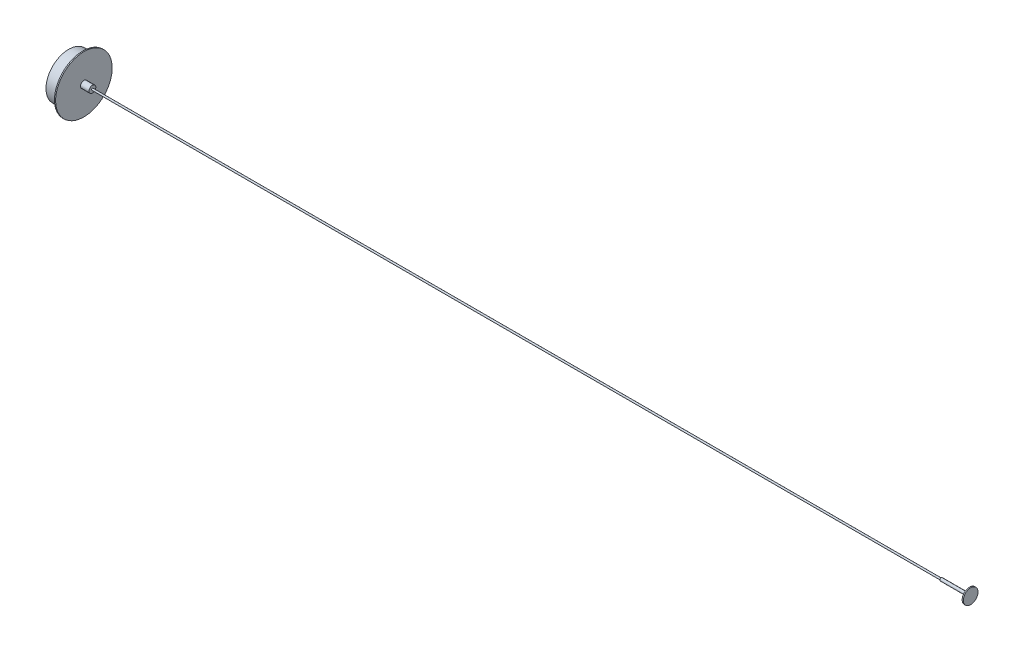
SolidWorks part; units mm, degrees
ref_plane "Alzado" through (0, 0, 0) normal (0, 0, 1) x (1, 0, 0)
ref_plane "Planta" through (0, 0, 0) normal (0, 1, 0) x (1, 0, 0)
ref_plane "Vista lateral" through (0, 0, 0) normal (1, 0, 0) x (0, 0, -1)
sketch "Croquis1" plane through (0, 0, 0) normal (0, 0, 1) x (1, 0, 0)
  line L0 (0, 0) -> (60, 0)
  line L2 (60, 0) -> (60, 80)
  dimension "D1" = 60
  dimension "D3" = 80
sketch "Croquis114" plane through (0, 0, 0) normal (-1, 0, 0) x (0, 0, 1)
  circle A0 centre (0, 0) radius 40
  dimension "D1" = 80
extrude "Saliente-Extruir1" add sketch "Croquis114" along normal blind 25
fillet "Redondeo1" radius 1 1 edges at (0, -40, 0)
sketch "Croquis115" plane through (0, 0, 0) normal (1, 0, 0) x (0, 0, -1)
  circle A0 centre (0, 0) radius 50
extrude "Saliente-Extruir2" add sketch "Croquis115" along normal blind 2
sketch "Croquis122" plane through (2, 0, 0) normal (1, 0, 0) x (0, 0, -1)
  circle A0 centre (0, 0) radius 6
  dimension "D1" = 12
extrude "Saliente-Extruir3" add sketch "Croquis122" along normal blind 15 separate body
sketch "Croquis123" plane through (17, 0, 0) normal (1, 0, 0) x (0, 0, -1)
  circle A0 centre (0, 0) radius 1.5
  dimension "D1" = 3
extrude "Saliente-Extruir4" add sketch "Croquis123" along normal blind 1500 separate body
sketch "Croquis124" plane through (1517, 0, 0) normal (1, 0, 0) x (0, 0, -1)
  circle A0 centre (0, 0) radius 2.5
  dimension "D1" = 5
extrude "Saliente-Extruir5" add sketch "Croquis124" along normal blind 50 separate body
sketch "Croquis125" plane through (1567, 0, 0) normal (1, 0, 0) x (0, 0, -1)
  circle A0 centre (0, 0) radius 13
  dimension "D1" = 26
extrude "Saliente-Extruir6" add sketch "Croquis125" along normal blind 2
